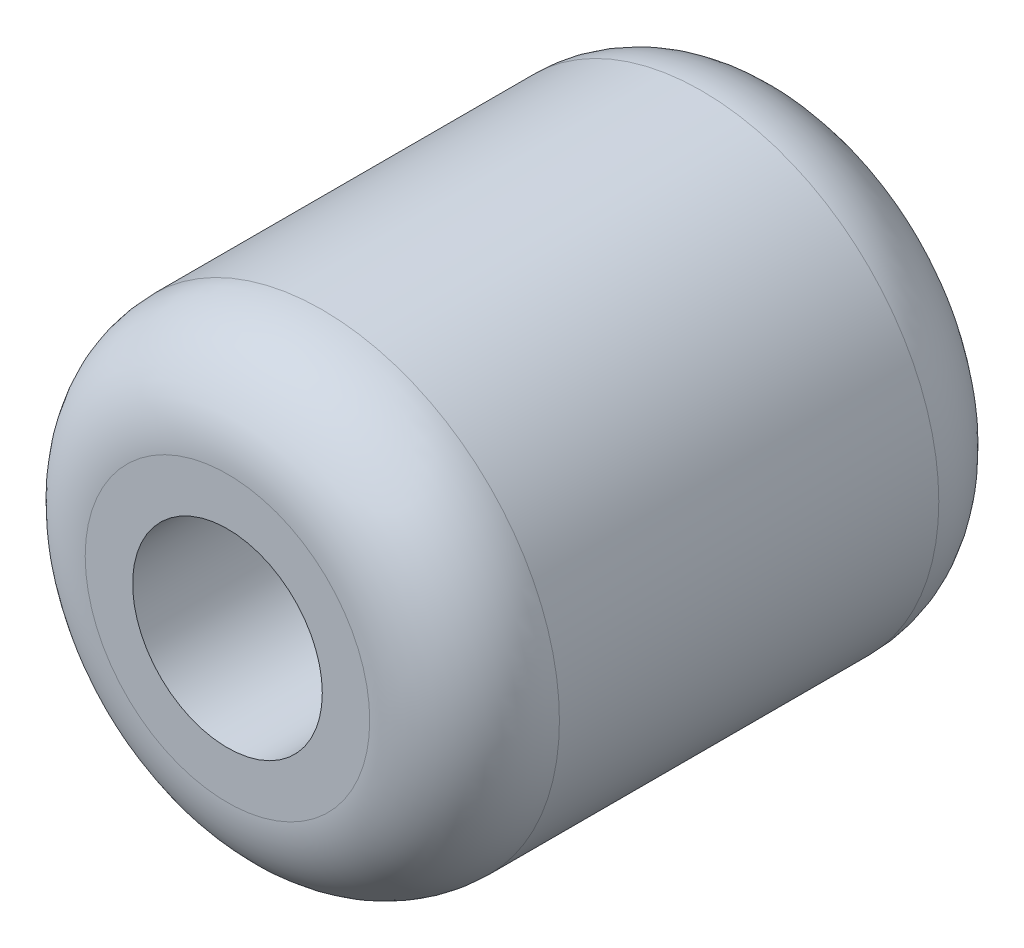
SolidWorks part; units mm, degrees
ref_plane "Plan1" through (0, 0, 0) normal (0, 0, 1) x (1, 0, 0)
ref_plane "Plan2" through (0, 0, 0) normal (0, 1, 0) x (1, 0, 0)
ref_plane "Plan3" through (0, 0, 0) normal (1, 0, 0) x (0, 0, -1)
sketch "Esquisse1" plane through (0, 0, 0) normal (0, 0, 1) x (1, 0, 0)
  circle A0 centre (0, 0) radius 2.5
  dimension "D1" = 5
extrude "cylindre+perçage" add sketch "Esquisse1" along normal blind 6 thin
fillet "arrondi" radius 1
